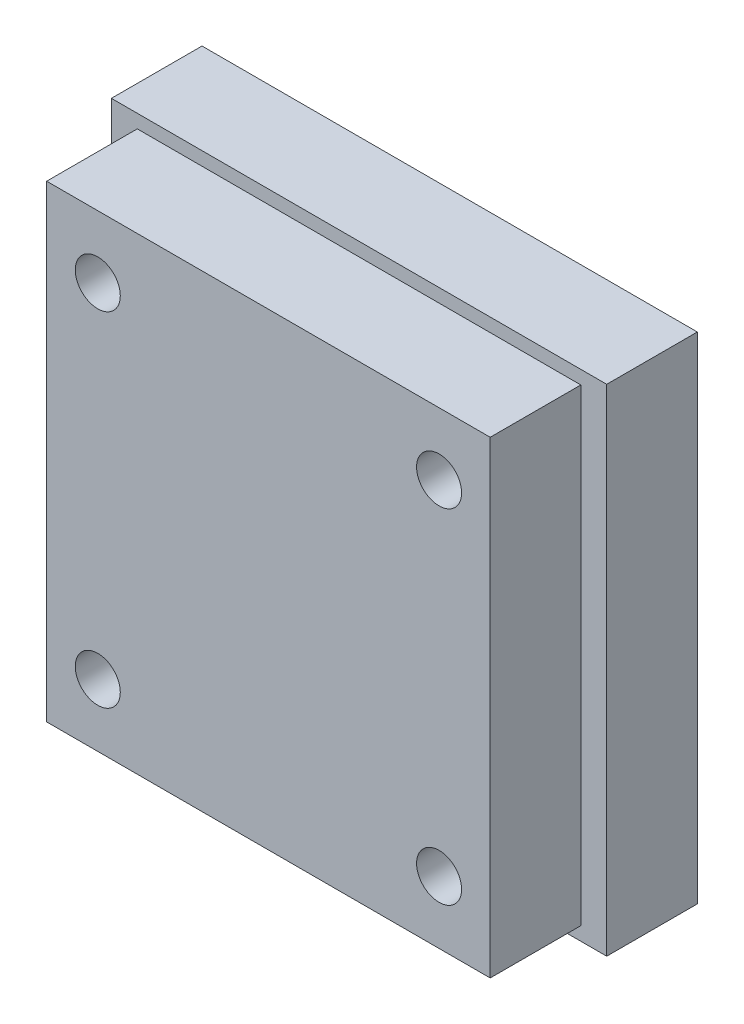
SolidWorks part; units mm, degrees
ref_plane "Front Plane" through (0, 0, 0) normal (0, 0, 1) x (1, 0, 0)
ref_plane "Top Plane" through (0, 0, 0) normal (0, 1, 0) x (1, 0, 0)
ref_plane "Right Plane" through (0, 0, 0) normal (1, 0, 0) x (0, 0, -1)
sketch "Sketch1" plane through (0, 0, 0) normal (0, 0, 1) x (1, 0, 0)
  line L1 (-22, -22) -> (22, -22)
  line L2 (-22, -22) -> (-22, 22)
  line L3 (-22, 22) -> (22, 22)
  line L4 (22, -22) -> (22, 22)
  line L5 (-22, -22) -> (22, 22) construction
  line L6 (-22, 22) -> (22, -22) construction
  point P0 (0, 0)
  dimension "D1" = 44
  dimension "D2" = 44
extrude "Boss-Extrude1" add sketch "Sketch1" along normal blind 8.05
sketch "Sketch2" plane through (0, 0, 8.05) normal (0, 0, 1) x (1, 0, 0)
  line L1 (-19.7, -20.8) -> (19.7, -20.8)
  line L2 (-19.7, -20.8) -> (-19.7, 20.8)
  line L3 (-19.7, 20.8) -> (19.7, 20.8)
  line L4 (19.7, -20.8) -> (19.7, 20.8)
  line L5 (-19.7, -20.8) -> (19.7, 20.8) construction
  line L6 (-19.7, 20.8) -> (19.7, -20.8) construction
  point P0 (0, 0)
  dimension "D1" = 39.4
  dimension "D2" = 41.6
extrude "Boss-Extrude2" add sketch "Sketch2" along normal blind 8.05
sketch "Sketch3" plane through (0, 0, 16.1) normal (0, 0, 1) x (1, 0, 0)
  line L0 (-19.7, 20.8) -> (-19.7, -20.8) construction
  line L1 (19.7, 20.8) -> (-19.7, 20.8) construction
  circle A0 centre (-15.16, 15.25) radius 2
  circle A1 centre (15.16, 15.25) radius 2
  circle A2 centre (15.16, -15.25) radius 2
  circle A3 centre (-15.16, -15.25) radius 2
  dimension "D1" = 4
  dimension "D2" = 4
  dimension "D3" = 4
  dimension "D4" = 4
  dimension "D5" = 30.32
  dimension "D6" = 30.32
  dimension "D7" = 30.5
  dimension "D8" = 30.5
  dimension "D9" = 4.54
  dimension "D10" = 5.55
extrude "Cut-Extrude1" cut sketch "Sketch3" against normal through all
